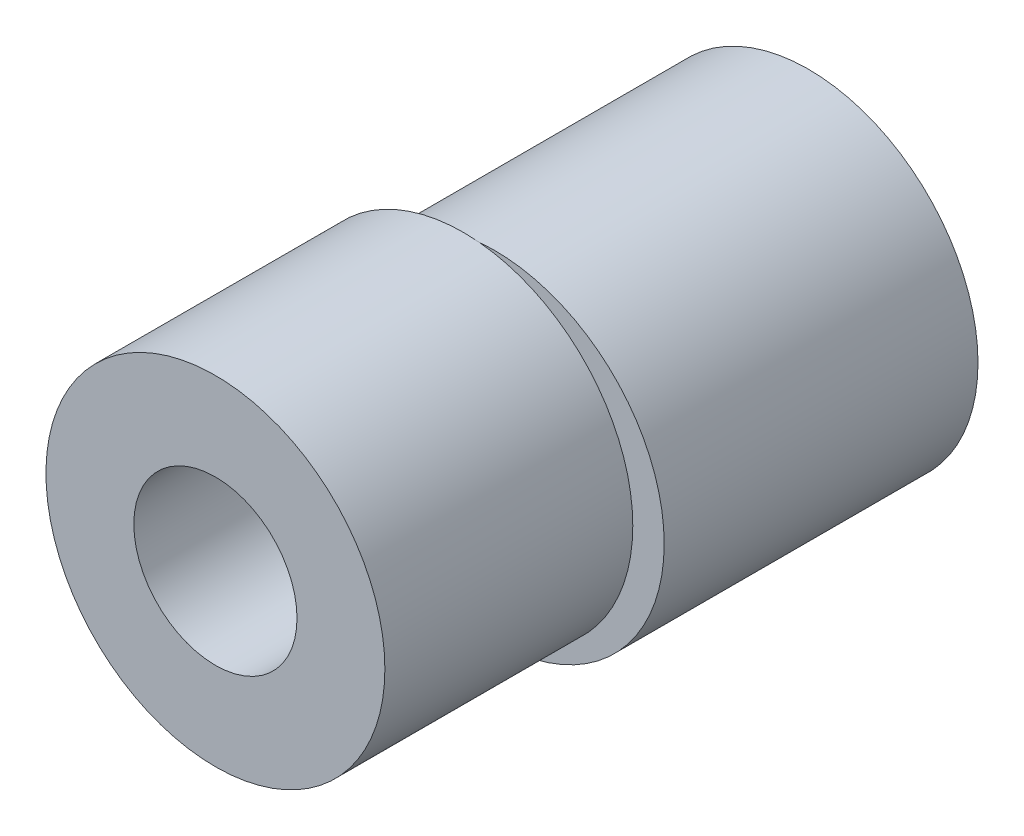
SolidWorks part; units mm, degrees
ref_plane "Ebene vorne" through (0, 0, 0) normal (0, 0, 1) x (1, 0, 0)
ref_plane "Ebene oben" through (0, 0, 0) normal (0, 1, 0) x (1, 0, 0)
ref_plane "Ebene rechts" through (0, 0, 0) normal (1, 0, 0) x (0, 0, -1)
sketch "Skizze1" plane through (0, 0, 0) normal (0, 0, 1) x (1, 0, 0)
  circle A0 centre (0, 0) radius 5.4
  dimension "D1" = 10.8
extrude "Aufsatz-Linear austragen1" add sketch "Skizze1" along normal blind 10 contours A0
sketch "Skizze2" plane through (0, 0, 10) normal (0, 0, 1) x (1, 0, 0)
  line L0 (0, 0) -> (1000, 0) construction
  circle A0 centre (-1, 0) radius 5.4
  dimension "D1" = 10.8
  dimension "D2" = 0
  dimension "D3" = 1
extrude "Aufsatz-Linear austragen2" add sketch "Skizze2" along normal blind 7.9
sketch "Skizze3" plane through (0, 0, 17.9) normal (0, 0, 1) x (1, 0, 0)
  circle A0 centre (-1, 0) radius 2.6
  dimension "D1" = 5.2
extrude "Schnitt-Linear austragen1" cut sketch "Skizze3" against normal up to next contours A0
ref_plane "Ebene2" through (0, 0, 0) normal (0, 0, -1) x (-1, 0, 0)
sketch "Skizze5" plane through (0, 0, 0) normal (0, 0, -1) x (-1, 0, 0)
  line L1 (3.075, 1.5666) -> (3.575, 1.5666)
  line L2 (3.075, 1.5666) -> (3.075, -2.414)
  line L3 (3.075, -2.414) -> (3.575, -2.414)
  line L4 (3.575, 1.5666) -> (3.575, -2.414)
  circle A0 centre (1, 0) radius 2.6 construction
  dimension "D2" = 2.575
  dimension "D1" = 0.5
extrude "Aufsatz-Linear austragen3" add sketch "Skizze5" against normal blind 7.9
